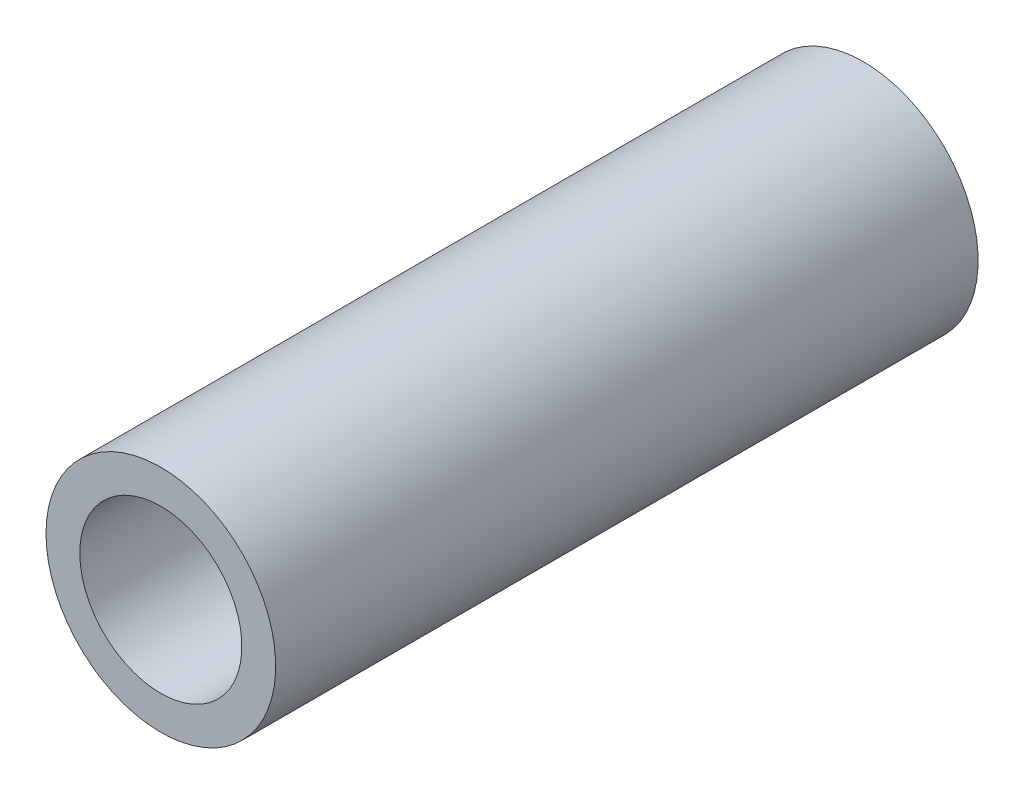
SolidWorks part; units mm, degrees
ref_plane "Plan de face" through (0, 0, 0) normal (0, 0, 1) x (1, 0, 0)
ref_plane "Plan de dessus" through (0, 0, 0) normal (0, 1, 0) x (1, 0, 0)
ref_plane "Plan de droite" through (0, 0, 0) normal (1, 0, 0) x (0, 0, -1)
sketch "Esquisse1" plane through (0, 0, 0) normal (0, 0, 1) x (1, 0, 0)
  circle A0 centre (0, 0) radius 8.5
  circle A1 centre (0, 0) radius 6
  dimension "D1" = 12
  dimension "D2" = 17
extrude "Extrusion1" add sketch "Esquisse1" along normal blind 52
